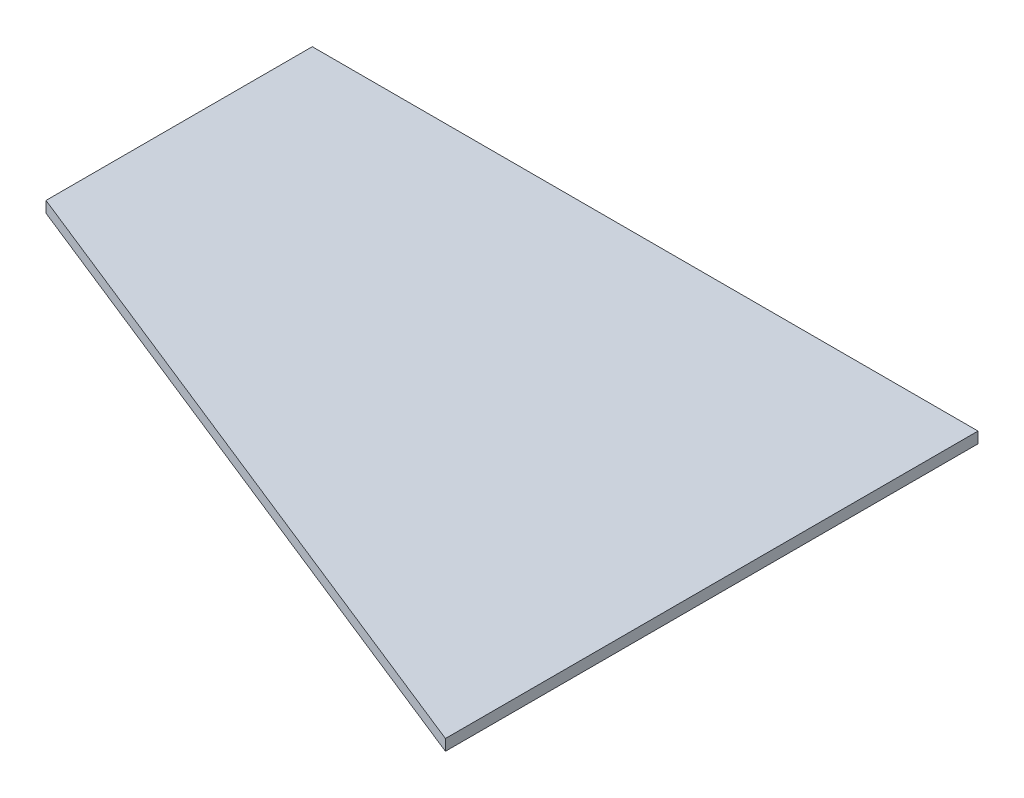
SolidWorks part; units mm, degrees
ref_plane "Front Plane" through (0, 0, 0) normal (1, 0, 0) x (0, 1, 0)
ref_plane "Top Plane" through (0, 0, 0) normal (0, 0, 1) x (0, 1, 0)
ref_plane "Right Plane" through (0, 0, 0) normal (0, 1, 0) x (-1, 0, 0)
sketch "Sketch1" plane through (0, 0, 0) normal (1, 0, 0) x (0, 1, 0)
  line L1 (-82.55, -76.2) -> (-76.2, -76.2)
  line L2 (-82.55, -76.2) -> (-82.55, 76.2)
  line L3 (-82.55, 76.2) -> (-76.2, 76.2)
  line L4 (-76.2, -76.2) -> (-76.2, 76.2)
ref_plane "Plane1" through (304.8, 0, 0) normal (1, 0, 0) x (0, 1, 0)
sketch "Sketch2" plane through (304.8, 0, 0) normal (1, 0, 0) x (0, 1, 0)
  line L1 (-158.75, -152.4) -> (-152.4, -152.4)
  line L2 (-158.75, -152.4) -> (-158.75, 152.4)
  line L3 (-158.75, 152.4) -> (-152.4, 152.4)
  line L4 (-152.4, -152.4) -> (-152.4, 152.4)
loft "Tapered_plywood_panel" add profiles "Sketch1", "Sketch2"
